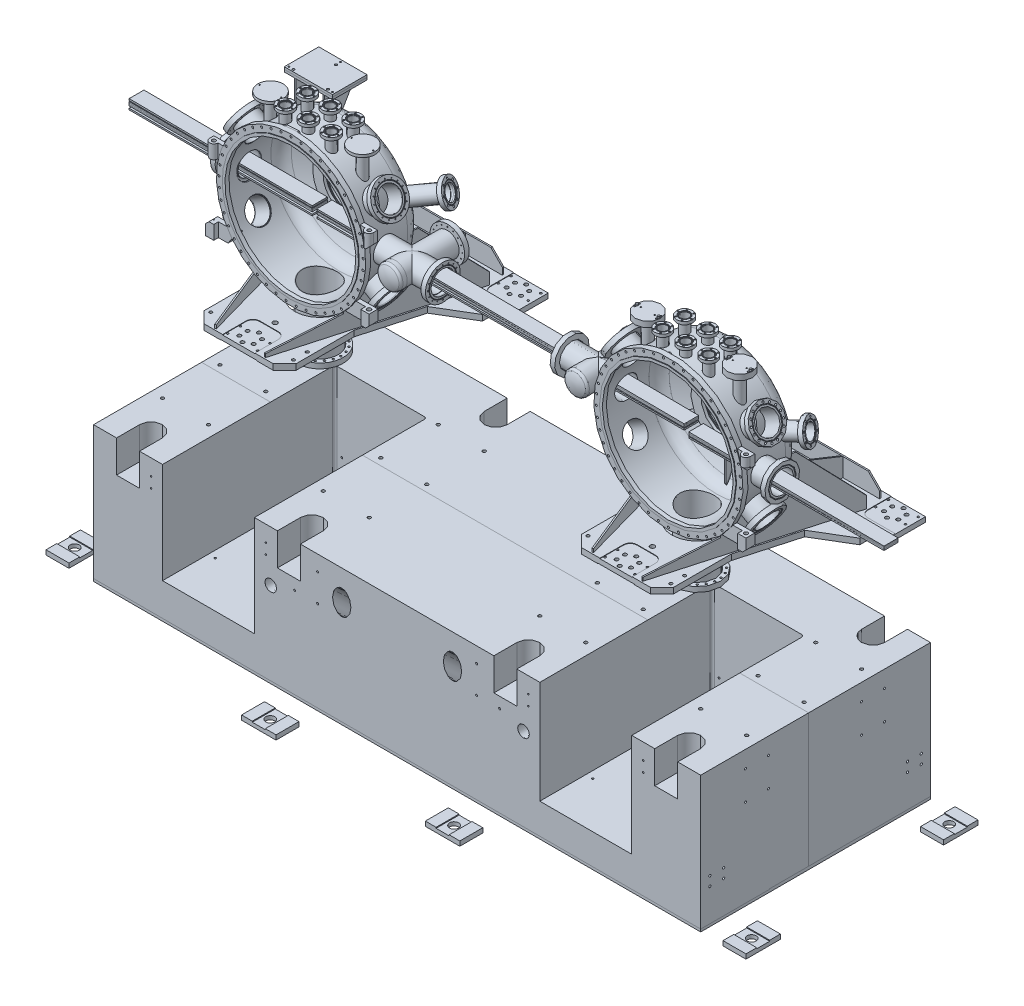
SolidWorks part; units mm, degrees
ref_plane "Front" through (0, 0, 0) normal (0, 0, 1) x (1, 0, 0)
ref_plane "Top" through (0, 0, 0) normal (0, 1, 0) x (1, 0, 0)
ref_plane "Right" through (0, 0, 0) normal (1, 0, 0) x (0, 0, -1)
imported_body "z1-57261000-1-solid1" [suppressed]
imported_body "z1-57261000-1-solid2" [suppressed]
imported_body "z1-57261000-1-solid3" [suppressed]
imported_body "z1-57261000-1-solid4" [suppressed]
imported_body "z1-57261000-1-solid5" [suppressed]
imported_body "z1-57261000-1-solid6" [suppressed]
imported_body "z1-57261000-1-solid7" [suppressed]
imported_body "z1-57261000-1-solid8" [suppressed]
imported_body "z1-57261000-1-solid9" [suppressed]
imported_body "z1-57261000-1-solid10" [suppressed]
imported_body "z1-57261000-1-solid11" [suppressed]
imported_body "z1-57261000-1-solid12" [suppressed]
imported_body "z1-57261000-1-solid13" [suppressed]
imported_body "z1-57261000-1-solid14" [suppressed]
imported_body "z1-57261000-1-solid15" [suppressed]
imported_body "z1-57261000-1-solid16" [suppressed]
imported_body "z1-57261000-1-solid17" [suppressed]
imported_body "z1-57261000-1-solid18" [suppressed]
imported_body "z1-57261000-1-solid19" [suppressed]
imported_body "z1-57261000-1-solid20" [suppressed]
imported_body "z1-57261000-1-solid21" [suppressed]
imported_body "z1-57261000-1-solid22" [suppressed]
imported_body "z1-57261000-1-solid23" [suppressed]
imported_body "z1-57261000-1-solid24" [suppressed]
imported_body "z1-57261000-1-solid25" [suppressed]
imported_body "57261001-1/57261005-1-solid1"
imported_body "57261001-1/resine-bm25-1-solid1"
imported_body "57261001-1/57261009-1/00611684-1-solid6"
imported_body "57261001-1/57261009-2/00611684-1-solid6"
imported_body "57261001-1/57261009-3/00611684-1-solid6"
imported_body "57261001-1/57261009-4/00611684-1-solid6"
imported_body "57261001-1/57261009-5/00611684-1-solid6"
imported_body "57261001-1/57261009-6/00611684-1-solid6"
imported_body "57261001-1/57261009-7/00611684-1-solid6"
imported_body "57261001-1/57261009-8/00611684-1-solid6"
imported_body "57261004-2/mono a v2-bm25-bm25-1-solid1"
imported_body "57261004-2/mono a v2-bm25-bm25-1-solid2"
imported_body "57261004-2/mono a v2-bm25-bm25-1-solid3"
imported_body "57261004-2/mono a v2-bm25-bm25-1-solid4"
imported_body "57261004-2/mono a v2-bm25-bm25-1-solid5"
imported_body "57261004-2/mono a v2-bm25-bm25-1-solid6"
imported_body "57261004-2/mono a v2-bm25-bm25-1-solid7"
imported_body "57261004-2/mono a v2-bm25-bm25-1-solid8"
imported_body "57261004-2/mono a v2-bm25-bm25-1-solid9"
imported_body "57261004-2/mono a v2-bm25-bm25-1-solid16"
imported_body "57261004-2/mono a v2-bm25-bm25-1-solid17"
imported_body "57261004-2/mono a v2-bm25-bm25-1-solid18"
imported_body "57261004-2/mono a v2-bm25-bm25-1-solid19"
imported_body "57261004-2/mono a v2-bm25-bm25-1-solid20"
imported_body "57261004-2/mono a v2-bm25-bm25-1-solid21"
imported_body "57261004-2/mono a v2-bm25-bm25-1-solid22"
imported_body "57261004-2/mono a v2-bm25-bm25-1-solid23"
imported_body "57261004-2/mono a v2-bm25-bm25-1-solid24"
imported_body "57261004-2/mono a v2-bm25-bm25-1-solid25"
imported_body "57261004-2/mono a v2-bm25-bm25-1-solid26"
imported_body "57261004-2/mono a v2-bm25-bm25-1-solid27"
imported_body "57261004-2/mono a v2-bm25-bm25-1-solid28"
imported_body "57261004-2/mono a v2-bm25-bm25-1-solid29"
imported_body "57261004-2/mono a v2-bm25-bm25-1-solid30"
imported_body "57261004-2/mono a v2-bm25-bm25-1-solid31"
imported_body "57261004-2/mono a v2-bm25-bm25-1-solid32"
imported_body "57261004-2/mono a v2-bm25-bm25-1-solid33"
imported_body "57261004-2/mono a v2-bm25-bm25-1-solid34"
imported_body "57261004-2/mono a v2-bm25-bm25-1-solid35"
imported_body "57261004-2/mono a v2-bm25-bm25-1-solid36"
imported_body "57261004-2/mono a v2-bm25-bm25-1-solid37"
imported_body "57261004-2/mono a v2-bm25-bm25-1-solid38"
imported_body "57261004-2/mono a v2-bm25-bm25-1-solid39"
imported_body "57261004-2/mono a v2-bm25-bm25-1-solid40"
imported_body "57261004-2/mono a v2-bm25-bm25-1-solid41"
imported_body "57261004-2/mono a v2-bm25-bm25-1-solid42"
imported_body "57261004-2/mono a v2-bm25-bm25-1-solid43"
imported_body "57261004-2/mono a v2-bm25-bm25-1-solid44"
imported_body "57261004-2/mono a v2-bm25-bm25-1-solid45"
imported_body "57261004-2/mono a v2-bm25-bm25-1-solid46"
imported_body "57261004-2/mono a v2-bm25-bm25-1-solid47"
imported_body "57261004-2/mono a v2-bm25-bm25-1-solid48"
imported_body "57261004-2/mono a v2-bm25-bm25-1-solid49"
imported_body "57261004-2/mono a v2-bm25-bm25-1-solid50"
imported_body "57261004-2/mono a v2-bm25-bm25-1-solid51"
imported_body "57261004-2/mono a v2-bm25-bm25-1-solid52"
imported_body "57261004-2/mono a v2-bm25-bm25-1-solid53"
imported_body "57261004-2/mono a v2-bm25-bm25-1-solid54"
imported_body "57261004-2/mono a v2-bm25-bm25-1-solid55"
imported_body "57261004-2/mono a v2-bm25-bm25-1-solid56"
imported_body "57261004-2/mono a v2-bm25-bm25-1-solid57"
imported_body "57261004-2/mono a v2-bm25-bm25-1-solid58"
imported_body "57261004-2/mono a v2-bm25-bm25-1-solid59"
imported_body "57261004-2/mono a v2-bm25-bm25-1-solid60"
imported_body "57261004-2/mono a v2-bm25-bm25-1-solid61"
imported_body "57261004-2/mono a v2-bm25-bm25-1-solid62"
imported_body "57261004-2/mono a v2-bm25-bm25-1-solid63"
imported_body "57261004-2/mono a v2-bm25-bm25-1-solid64"
imported_body "57261004-2/mono a v2-bm25-bm25-1-solid65"
imported_body "57261004-2/mono a v2-bm25-bm25-1-solid66"
imported_body "57261004-2/mono a v2-bm25-bm25-1-solid67"
imported_body "57261004-2/mono a v2-bm25-bm25-1-solid68"
imported_body "57261004-2/mono a v2-bm25-bm25-1-solid69"
imported_body "57261004-2/mono a v2-bm25-bm25-1-solid70"
imported_body "57261004-3/mono1-1/base mono1-1-solid1"
imported_body "57261004-3/mono1-1/base mono1-1-solid2"
imported_body "57261004-3/mono1-1/base mono1-1-solid3"
imported_body "57261004-3/mono1-1/base mono1-1-solid4"
imported_body "57261004-3/mono1-1/base mono1-1-solid5"
imported_body "57261004-3/mono1-1/base mono1-1-solid6"
imported_body "57261004-3/mono1-1/base mono1-1-solid7"
imported_body "57261004-3/mono1-1/base mono1-1-solid8"
imported_body "57261004-3/mono1-1/base mono1-1-solid9"
imported_body "57261004-3/mono1-1/base mono1-1-solid10"
imported_body "57261004-3/mono1-1/base mono1-1-solid11"
imported_body "57261004-3/mono1-1/base mono1-1-solid12"
imported_body "57261004-3/mono1-1/base mono1-1-solid13"
imported_body "57261004-3/mono1-1/57241000 mono seul v2-bm25-bm25-1-solid1"
imported_body "57261004-3/mono1-1/57241000 mono seul v2-bm25-bm25-1-solid2"
imported_body "57261004-3/mono1-1/57241000 mono seul v2-bm25-bm25-1-solid3"
imported_body "57261004-3/mono1-1/57241000 mono seul v2-bm25-bm25-1-solid4"
imported_body "57261004-3/mono1-1/57241000 mono seul v2-bm25-bm25-1-solid5"
imported_body "57261004-3/mono1-1/57241000 mono seul v2-bm25-bm25-1-solid6"
imported_body "57261004-3/mono1-1/57241000 mono seul v2-bm25-bm25-1-solid7"
imported_body "57261004-3/mono1-1/57241000 mono seul v2-bm25-bm25-1-solid8"
imported_body "57261004-3/mono1-1/57241000 mono seul v2-bm25-bm25-1-solid9"
imported_body "57261004-3/mono1-1/57241000 mono seul v2-bm25-bm25-1-solid10"
imported_body "57261004-3/mono1-1/57241000 mono seul v2-bm25-bm25-1-solid11"
imported_body "57261004-3/mono1-1/57241000 mono seul v2-bm25-bm25-1-solid12"
imported_body "57261004-3/mono1-1/57241000 mono seul v2-bm25-bm25-1-solid13"
imported_body "57261004-3/mono1-1/57241000 mono seul v2-bm25-bm25-1-solid14"
imported_body "57261004-3/mono1-1/57241000 mono seul v2-bm25-bm25-1-solid15"
imported_body "57261004-3/mono1-1/57241000 mono seul v2-bm25-bm25-1-solid16"
imported_body "57261004-3/mono1-1/57241000 mono seul v2-bm25-bm25-1-solid17"
imported_body "57261004-3/mono1-1/57241000 mono seul v2-bm25-bm25-1-solid18"
imported_body "57261004-3/mono1-1/57241000 mono seul v2-bm25-bm25-1-solid19"
imported_body "57261004-3/mono1-1/57241000 mono seul v2-bm25-bm25-1-solid20"
imported_body "57261004-3/mono1-1/57241000 mono seul v2-bm25-bm25-1-surface1"
pattern_linear "Répétition linéaire1" count 2 spacing 20
delete or keep bodies "Corps-Supprimer/Garder 1" type delete bodies bodies 638 639 640 641 642 643 644 645 646 653 654 655 656 657 658 659 660 661 662 663 664 665 666 667 668 669 670 671 672 673 674 675 676 677 678 679 680 681 682 683
